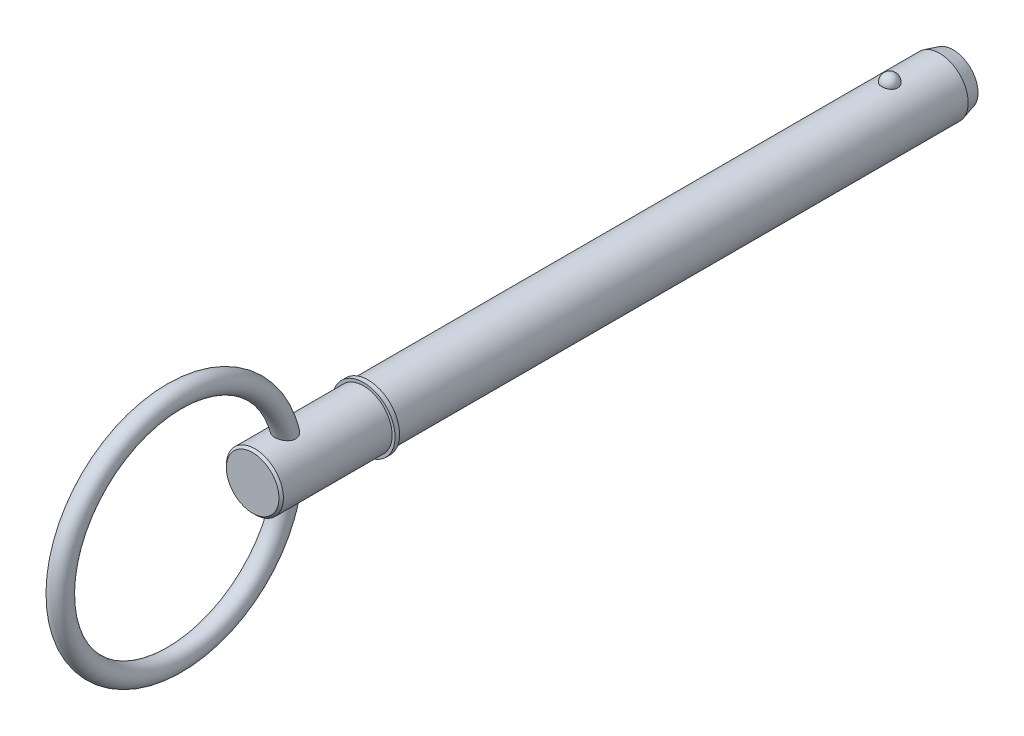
SolidWorks part; units mm, degrees
ref_plane "Front Plane" through (0, 0, 0) normal (0, 0, 1) x (1, 0, 0)
ref_plane "Top Plane" through (0, 0, 0) normal (0, 1, 0) x (1, 0, 0)
ref_plane "Right Plane" through (0, 0, 0) normal (1, 0, 0) x (0, 0, -1)
sketch "Sketch2" plane through (0, 0, 0) normal (0, 0, 1) x (1, 0, 0)
  circle A0 centre (0, 0) radius 6.35
  point P3 (0, 6.35)
  dimension "D1" = 12.7
extrude "Boss-Extrude1" add sketch "Sketch2" along normal blind 114.3
sketch "Sketch3" plane through (0, 0, 0) normal (0, 0, -1) x (-1, 0, 0)
  circle A0 centre (0, 0) radius 6.35
  dimension "D1" = 12.7
extrude "Boss-Extrude2" add sketch "Sketch3" along normal blind 15.88
chamfer "Chamfer1" distance 3 angle 15 1 edges at (-6.35, 0, -15.88)
sketch "Sketch18" plane through (0, 0, 0) normal (1, 0, 0) x (0, 0, -1)
  line L0 (12.88, 6.35) -> (-114.3, 6.35) construction
  line L1 (1.78, 8.13) -> (1.78, 4.57)
  line L2 (-114.3, -6.35) -> (12.88, -6.35) construction
  arc A0 (1.78, 8.13) -> (1.78, 4.57) centre (1.78, 6.35) ccw
  point P4 (0, 6.35)
  dimension "D1" = 14.48
revolve "Revolve1" add sketch "Sketch18" angle 360 about L1
sketch "Sketch19" plane through (0, 0, 0) normal (1, 0, 0) x (0, 0, -1)
  line L0 (-33.7288, 0) -> (-46.4542, 0) construction
sketch "Sketch20" plane through (0, 0, 0) normal (1, 0, 0) x (0, 0, -1)
  line L0 (-114.3, 0) -> (-114.3, 7)
  line L1 (-114.3, 6.35) -> (-114.3, -6.35) construction
  line L2 (-114.3, 7) -> (-115.3, 7)
  line L3 (-115.3, 7) -> (-115.3, 0)
  line L4 (-33.7288, 0) -> (-46.4542, 0) construction
  line L5 (-115.3, 0) -> (-114.3, 0)
  dimension "D1" = 7
  dimension "D2" = 1
revolve "Revolve2" add sketch "Sketch20" angle 360 about L0
sketch "Sketch21" plane through (0, 0, 114.3) normal (0, 0, -1) x (-1, 0, 0)
  circle A0 centre (0, 0) radius 6.35
  dimension "D1" = 12.7
extrude "Boss-Extrude3" add sketch "Sketch21" against normal blind 25.7
chamfer "Chamfer2" distance 0.5 angle 45 1 edges at (-6.35, 0, 140)
sketch "Sketch23" plane through (0, 0, 0) normal (1, 0, 0) x (0, 0, -1)
  line L0 (-140, 5.85) -> (-140, -5.85) construction
  circle A0 centre (-157.4, 0) radius 25.4
  point P2 (-132, 0)
  dimension "D1" = 50.8
  dimension "D2" = 8
sketch "Sketch24" plane through (0, 0, 0) normal (0, 1, 0) x (1, 0, 0)
  circle A0 centre (0, -132) radius 2.25
  dimension "D1" = 4.5
sweep "Sweep1" add profiles "Sketch24" path "Sketch23"
